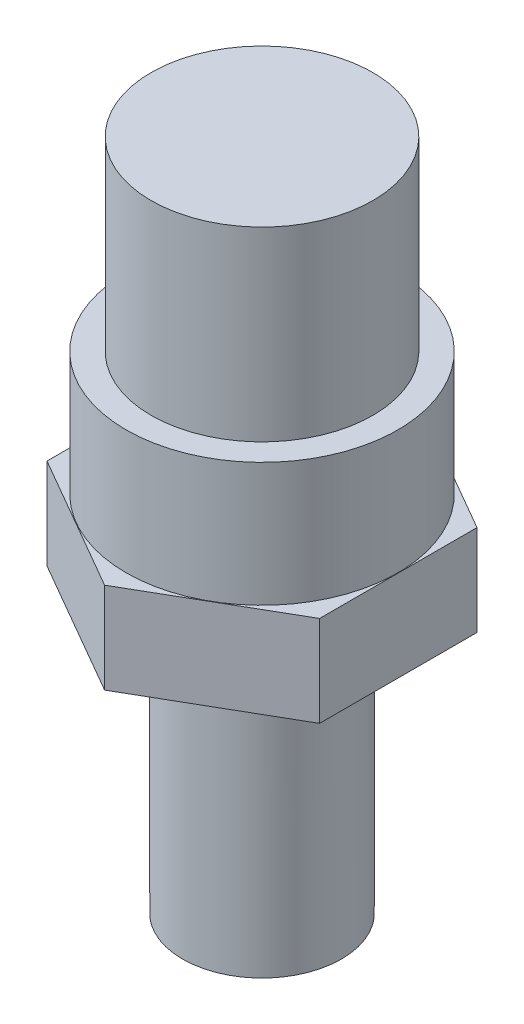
SolidWorks part; units mm, degrees
ref_plane "Front Plane" through (0, 0, 0) normal (0, 0, 1) x (1, 0, 0)
ref_plane "Top Plane" through (0, 0, 0) normal (0, 1, 0) x (1, 0, 0)
ref_plane "Right Plane" through (0, 0, 0) normal (1, 0, 0) x (0, 0, -1)
sketch "Sketch1" plane through (0, 0, 0) normal (0, 1, 0) x (1, 0, 0)
  line L1 (0, 10.9985) -> (-9.525, 5.4993)
  line L2 (-9.525, 5.4993) -> (-9.525, -5.4993)
  line L3 (-9.525, -5.4993) -> (0, -10.9985)
  line L4 (0, -10.9985) -> (9.525, -5.4993)
  line L5 (9.525, -5.4993) -> (9.525, 5.4993)
  line L6 (9.525, 5.4993) -> (0, 10.9985)
  circle A0 centre (0, 0) radius 9.525 construction
extrude "Boss-Extrude1" add sketch "Sketch1" along normal blind 28
sketch "Sketch2" plane through (0, 0, 0) normal (0, -1, 0) x (1, 0, 0)
  circle A0 centre (0, 0) radius 5.5562
  dimension "D1" = 11.1125
extrude "Boss-Extrude2" add sketch "Sketch2" along normal blind 19
sketch "Sketch3" plane through (0, 0, 0) normal (1, 0, 0) x (0, 0, -1)
  line L0 (0, 28) -> (0, 10.177) construction
  line L1 (-5.4993, 28) -> (5.4993, 28) construction
  line L2 (5.4993, 28) -> (10.9985, 28) construction
  line L3 (7.75, 28) -> (16.5723, 28)
  line L4 (7.75, 28) -> (7.75, 15)
  line L5 (7.75, 15) -> (16.5723, 15)
  line L6 (16.5723, 28) -> (16.5723, 15)
  dimension "D1" = 15.5
  dimension "D2" = 13
revolve "Cut-Revolve1" cut sketch "Sketch3" angle 360 about L0
sketch "Sketch4" plane through (0, 0, 0) normal (1, 0, 0) x (0, 0, -1)
  line L0 (5.4993, 0) -> (10.9985, 0) construction
  line L1 (9.5, 15.6326) -> (16.5707, 15.6326)
  line L2 (9.5, 15.6326) -> (9.5, 6.35)
  line L3 (9.5, 6.35) -> (16.5707, 6.35)
  line L4 (16.5707, 15.6326) -> (16.5707, 6.35)
  line L5 (0, 28) -> (0, 9.103) construction
  line L6 (7.75, 28) -> (-7.75, 28) construction
  dimension "D1" = 6.35
  dimension "D2" = 19
revolve "Cut-Revolve2" cut sketch "Sketch4" angle 360 about L5
